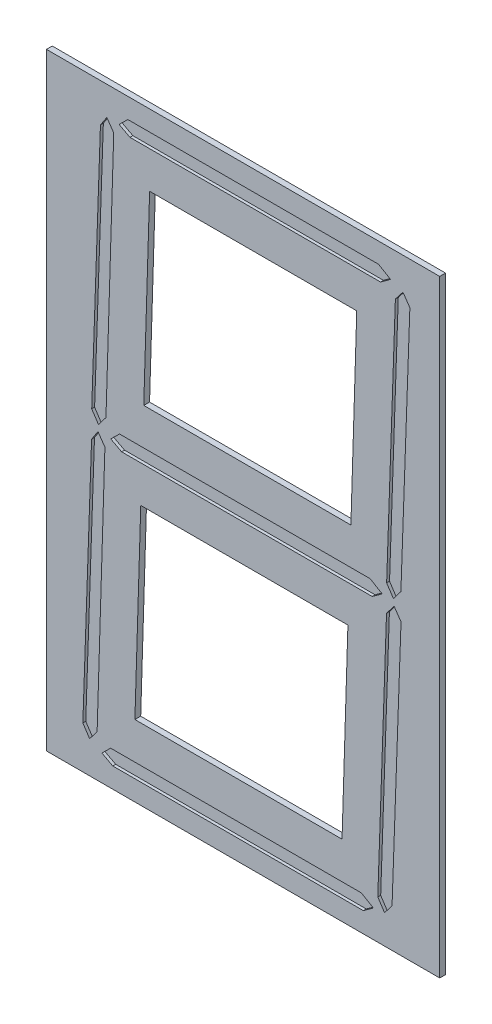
SolidWorks part; units mm, degrees
ref_plane "Front Plane" through (0, 0, 0) normal (0, 0, 1) x (1, 0, 0)
ref_plane "Top Plane" through (0, 0, 0) normal (0, 1, 0) x (1, 0, 0)
ref_plane "Right Plane" through (0, 0, 0) normal (1, 0, 0) x (0, 0, -1)
sketch "Sketch1" plane through (0, 0, 0) normal (0, 0, 1) x (1, 0, 0)
  line L0 (0, 304.8) -> (0, 271.9) construction
  line L1 (-203.2, 304.8) -> (203.2, 304.8)
  line L2 (-203.2, 304.8) -> (-203.2, -304.8)
  line L3 (-203.2, -304.8) -> (203.2, -304.8)
  line L4 (203.2, 304.8) -> (203.2, -304.8)
  line L5 (-203.2, 304.8) -> (203.2, -304.8) construction
  line L6 (-203.2, -304.8) -> (203.2, 304.8) construction
  line L7 (-133.35, 271.9) -> (-153.55, 271.9) construction
  line L8 (-133.35, 279.4) -> (133.35, 279.4)
  line L9 (-133.35, 279.4) -> (-133.35, 264.4)
  line L10 (-133.35, 264.4) -> (133.35, 264.4)
  line L11 (133.35, 279.4) -> (133.35, 264.4)
  line L12 (-133.35, 279.4) -> (133.35, 264.4) construction
  line L13 (-133.35, 264.4) -> (133.35, 279.4) construction
  line L14 (-153.55, 271.9) -> (-153.55, 138.55) construction
  line L16 (-146.05, 271.9) -> (-161.05, 271.9)
  line L17 (-146.05, 271.9) -> (-146.05, 5.2)
  line L18 (-146.05, 5.2) -> (-161.05, 5.2)
  line L19 (-161.05, 271.9) -> (-161.05, 5.2)
  line L20 (-146.05, 271.9) -> (-161.05, 5.2) construction
  line L21 (-146.05, 5.2) -> (-161.05, 271.9) construction
  line L22 (-133.35, 7.5) -> (133.35, 7.5)
  line L23 (-133.35, 7.5) -> (-133.35, -7.5)
  line L24 (140.8529, 5.2) -> (155.8529, 271.9) construction
  line L25 (140.8529, 271.9) -> (155.8529, 5.2) construction
  line L26 (148.3529, 271.9) -> (148.3529, 138.55) construction
  line L27 (155.8529, 271.9) -> (155.8529, 5.2)
  line L28 (140.8529, 5.2) -> (155.8529, 5.2)
  line L29 (140.8529, 271.9) -> (140.8529, 5.2)
  line L30 (140.8529, 271.9) -> (155.8529, 271.9)
  line L31 (148.3529, -271.9) -> (148.3529, -138.55) construction
  line L32 (140.8529, -271.9) -> (155.8529, -5.2) construction
  line L33 (140.8529, -5.2) -> (155.8529, -271.9) construction
  line L34 (-146.05, -5.2) -> (-161.05, -271.9) construction
  line L35 (-146.05, -271.9) -> (-161.05, -5.2) construction
  line L36 (-153.55, -271.9) -> (-153.55, -138.55) construction
  line L37 (-133.35, -264.4) -> (133.35, -279.4) construction
  line L38 (-133.35, -279.4) -> (133.35, -264.4) construction
  line L39 (-203.2, 304.8) -> (203.2, -304.8) construction
  line L40 (-203.2, -304.8) -> (203.2, 304.8) construction
  line L41 (140.8529, -271.9) -> (155.8529, -271.9)
  line L42 (140.8529, -271.9) -> (140.8529, -5.2)
  line L43 (140.8529, -5.2) -> (155.8529, -5.2)
  line L44 (155.8529, -271.9) -> (155.8529, -5.2)
  line L45 (-161.05, -271.9) -> (-161.05, -5.2)
  line L46 (-146.05, -5.2) -> (-161.05, -5.2)
  line L47 (-146.05, -271.9) -> (-146.05, -5.2)
  line L48 (-146.05, -271.9) -> (-161.05, -271.9)
  line L49 (133.35, -279.4) -> (133.35, -264.4)
  line L50 (-133.35, -264.4) -> (133.35, -264.4)
  line L51 (-133.35, -279.4) -> (-133.35, -264.4)
  line L52 (-133.35, -279.4) -> (133.35, -279.4)
  line L53 (-133.35, -7.5) -> (133.35, -7.5)
  line L54 (133.35, 7.5) -> (133.35, -7.5)
  line L55 (-133.35, 7.5) -> (133.35, -7.5) construction
  line L56 (-133.35, -7.5) -> (133.35, 7.5) construction
  point P0 (0, 0)
  point P19 (0, 0)
  point P46 (0, 0)
  dimension "D1" = 609.6
  dimension "D2" = 406.4
  dimension "D3" = 32.9
  dimension "D4" = 15
  dimension "D5" = 266.7
  dimension "D6" = 20.2
  dimension "D7" = 133.35
  dimension "D8" = 266.7
  dimension "D9" = 15
  dimension "D10" = 15
  dimension "D11" = 266.7
extrude "Boss-Extrude1" add sketch "Sketch1" against normal blind 6 contours L2 L3 L4 L1
sketch "Sketch4" plane through (0, 0, 0) normal (0, 0, 1) x (1, 0, 0)
  line L0 (0, 279.4) -> (0, 271.9) construction
  line L1 (-119.0657, 284.035) -> (139.899, 284.035)
  line L2 (-134.6878, -302.3089) -> (124.2768, -302.3089)
  line L3 (153.9341, -283.1595) -> (163.2122, -24.3859)
  line L4 (124.2768, -302.3089) -> (134.62, -294.7959)
  line L5 (0, 304.8) -> (0, 283.972) construction
  line L6 (-203.2, 304.8) -> (203.2, 304.8) construction
  line L7 (142.0568, 269.1911) -> (152.4, 276.7041)
  line L8 (-116.9078, 269.1911) -> (142.0568, 269.1911)
  line L9 (-149.4569, -4.1424) -> (-141.7219, 5.9481)
  line L10 (-140.8491, 275.0756) -> (-140.8491, -4.3244) construction
  line L11 (152.4, 279.4) -> (152.4, 264.4)
  line L12 (-149.4569, -4.1424) -> (-156.4598, 6.4523)
  line L13 (-141.7219, 5.9481) -> (-133.669, 264.7627)
  line L14 (152.4, 276.7041) -> (139.899, 284.035)
  line L15 (-128.1492, 275.1357) -> (-119.0657, 284.035)
  line L16 (-128.1492, 275.1357) -> (-116.9078, 269.1911)
  line L17 (-147.4316, 264.9865) -> (-156.4598, 6.4523)
  line L18 (-145.9292, -296.3643) -> (-136.8457, -287.465)
  line L19 (152.4, 271.9) -> (165.1, 271.9) construction
  line L20 (163.0781, 2.5905) -> (172.3562, 261.3641)
  line L21 (-140.8491, 275.0756) -> (-147.4316, 264.9865)
  line L22 (-140.8491, 275.0756) -> (-133.669, 264.7627)
  line L23 (165.225, 271.7109) -> (172.3562, 261.3641)
  line L24 (155.3431, -7.5) -> (148.3402, 3.0947)
  line L25 (155.3431, -7.5) -> (163.0781, 2.5905)
  line L26 (157.3684, 261.629) -> (148.3402, 3.0947)
  line L27 (165.225, 271.7109) -> (157.3684, 261.629)
  line L28 (-136.7852, -10.6143) -> (-127.7017, -1.715)
  line L29 (133.4208, -16.5589) -> (143.764, -9.0459)
  line L30 (-136.7852, -10.6143) -> (-125.5438, -16.5589)
  line L31 (-125.5438, -16.5589) -> (133.4208, -16.5589)
  line L32 (-127.7017, -1.715) -> (131.263, -1.715)
  line L33 (143.764, -9.0459) -> (131.263, -1.715)
  line L34 (-136.8457, -287.465) -> (122.119, -287.465)
  line L35 (-145.9292, -296.3643) -> (-134.6878, -302.3089)
  line L36 (134.62, -294.7959) -> (122.119, -287.465)
  line L40 (-156.5756, -20.7635) -> (-165.6038, -279.2977)
  line L41 (-158.6009, -289.8924) -> (-165.6038, -279.2977)
  line L42 (156.081, -14.0391) -> (148.2244, -24.121)
  line L43 (146.1991, -293.25) -> (153.9341, -283.1595)
  line L44 (146.1991, -293.25) -> (139.1962, -282.6553)
  line L45 (-149.9931, -10.6744) -> (-142.813, -20.9873)
  line L46 (156.081, -14.0391) -> (163.2122, -24.3859)
  line L47 (148.2244, -24.121) -> (139.1962, -282.6553)
  line L48 (-158.6009, -289.8924) -> (-150.8659, -279.8019)
  line L49 (-149.9931, -10.6744) -> (-156.5756, -20.7635)
  line L50 (-150.8659, -279.8019) -> (-142.813, -20.9873)
  point P0 (0, 0)
  dimension "D1" = 20.828
  dimension "D3" = 7.5
  dimension "D4" = 15
  dimension "D5" = 12.7
  dimension "D6" = 279.4
  dimension "D7" = 12.7
  dimension "D9" = 70.937
extrude "Cut-Extrude1" cut sketch "Sketch4" against normal blind 3 contours L15 L16 L8 L7 L14 L1 | L22 L21 L17 L12 L9 L13 | L31 L29 L33 L32 L28 L30 | L3 L46 L42 L47 L44 L43 | L26 L24 L25 L20 L23 L27 | L40 L41 L48 L50 L45 L49 | L34 L36 L4 L2 L35 L18
sketch "Sketch5" plane through (0, 0, 0) normal (0, 0, 1) x (1, 0, 0)
  line L0 (0, -302.3089) -> (0, -323.1369) construction
  line L3 (-134.6878, -302.3089) -> (124.2768, -302.3089) construction
  line L5 (-203.2, -302.3089) -> (203.2, -302.3089)
  line L6 (-203.2, -302.3089) -> (-203.2, -323.1369)
  line L7 (-203.2, -323.1369) -> (203.2, -323.1369)
  line L8 (203.2, -302.3089) -> (203.2, -323.1369)
  line L9 (-203.2, -302.3089) -> (203.2, -323.1369) construction
  line L10 (-203.2, -323.1369) -> (203.2, -302.3089) construction
  point P5 (0, -312.7229)
  dimension "D1" = 20.828
  dimension "D2" = 406.4
  dimension "D3" = 20.828
extrude "Boss-Extrude2" add sketch "Sketch5" against normal blind 6
sketch "Sketch6" plane through (0, 0, 0) normal (0, 0, 1) x (1, 0, 0)
  line L0 (122.119, -287.465) -> (123.4494, -249.365) construction
  line L1 (-136.8457, -287.465) -> (122.119, -287.465) construction
  line L2 (140.3587, -249.365) -> (102.2587, -249.365) construction
  line L3 (148.2244, -24.121) -> (139.1962, -282.6553) construction
  line L4 (-136.8457, -287.465) -> (-135.5138, -249.3246) construction
  line L5 (-136.8457, -287.465) -> (122.119, -287.465) construction
  line L6 (-149.9176, -249.3246) -> (-111.8176, -249.3246) construction
  line L7 (-150.8659, -279.8019) -> (-142.813, -20.9873) construction
  line L8 (-105.7607, -54.6589) -> (-104.4302, -16.5589) construction
  line L9 (-125.5438, -16.5589) -> (133.4208, -16.5589) construction
  line L10 (-143.8607, -54.6589) -> (-105.7607, -54.6589) construction
  line L11 (102.2587, -249.365) -> (-111.8176, -249.3246)
  line L12 (102.2587, -249.365) -> (108.3156, -54.6993)
  line L13 (-111.8176, -249.3246) -> (-105.7607, -54.6589)
  line L14 (108.3156, -54.6993) -> (-105.7607, -54.6589)
  line L15 (131.263, -1.715) -> (132.5934, 36.385) construction
  line L16 (-127.7017, -1.715) -> (131.263, -1.715) construction
  line L17 (149.5027, 36.385) -> (111.4027, 36.385) construction
  line L18 (157.3684, 261.629) -> (148.3402, 3.0947) construction
  line L19 (-127.7017, -1.715) -> (-126.3712, 36.385) construction
  line L20 (-127.7017, -1.715) -> (131.263, -1.715) construction
  line L21 (-140.7749, 36.385) -> (-102.6749, 36.385) construction
  line L22 (-141.7219, 5.9481) -> (-133.669, 264.7627) construction
  line L23 (-116.9078, 269.1911) -> (-118.2383, 231.0911) construction
  line L24 (-116.9078, 269.1911) -> (142.0568, 269.1911) construction
  line L25 (-134.7167, 231.0911) -> (-96.6167, 231.0911) construction
  line L26 (111.4027, 36.385) -> (-102.6749, 36.385)
  line L27 (111.4027, 36.385) -> (117.4609, 231.0911)
  line L28 (-102.6749, 36.385) -> (-96.6167, 231.0911)
  line L29 (117.4609, 231.0911) -> (-96.6167, 231.0911)
  point P8 (-1.7124, -152.012)
  point P50 (108.3156, 36.385)
  dimension "D1" = 92
  dimension "D2" = 38.1
  dimension "D3" = 38.1
  dimension "D4" = 88
  dimension "D5" = 38.1
  dimension "D6" = 92
  dimension "D7" = 92
  dimension "D8" = 38.1
  dimension "D9" = 38.1
  dimension "D10" = 38.1
  dimension "D11" = 88
  dimension "D12" = 38.1
  dimension "D13" = 38.1
  dimension "D14" = 92
  dimension "D15" = 38.1
  dimension "D16" = 38.1
extrude "Cut-Extrude2" cut sketch "Sketch6" against normal blind 172.624 and the other way blind 174.244
